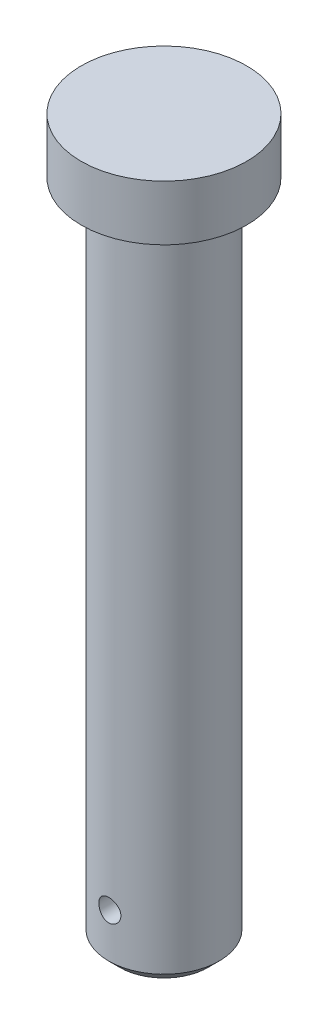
SolidWorks part; units mm, degrees
ref_plane "Plan de face" through (0, 0, 0) normal (0, 0, 1) x (1, 0, 0)
ref_plane "Plan de dessus" through (0, 0, 0) normal (0, 1, 0) x (1, 0, 0)
ref_plane "Plan de droite" through (0, 0, 0) normal (1, 0, 0) x (0, 0, -1)
sketch "Esquisse1" plane through (0, 0, 0) normal (0, 1, 0) x (1, 0, 0)
  circle A0 centre (0, 0) radius 10
  dimension "D1" = 20
extrude "Extrusion1" add sketch "Esquisse1" along normal blind 120
sketch "Esquisse2" plane through (0, 120, 0) normal (0, 1, 0) x (1, 0, 0)
  circle A0 centre (0, 0) radius 15
  dimension "D1" = 30
extrude "Extrusion2" add sketch "Esquisse2" along normal blind 10
sketch "Esquisse3" plane through (0, 0, 0) normal (0, 0, 1) x (1, 0, 0)
  line L0 (-10, 0) -> (10, 0) construction
  circle A0 centre (0, 10) radius 2
  dimension "D1" = 4
  dimension "D2" = 10
extrude "Extrusion3" cut sketch "Esquisse3" along normal through all and the other way through all
chamfer "Chanfrein1" distance 2 angle 45 1 edges at (0, 0, 10)
